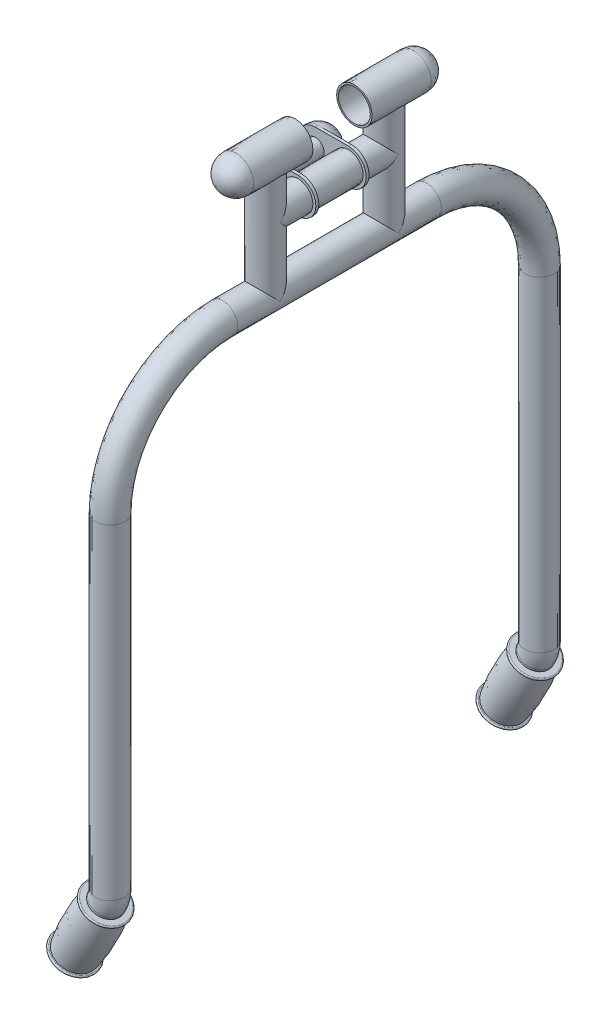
SolidWorks part; units mm, degrees
ref_plane "Plan de face" through (0, 0, 0) normal (0, 0, 1) x (1, 0, 0)
ref_plane "Plan de dessus" through (0, 0, 0) normal (0, 1, 0) x (1, 0, 0)
ref_plane "Plan de droite" through (0, 0, 0) normal (1, 0, 0) x (0, 0, -1)
sketch "Esquisse1" plane through (0, 0, 0) normal (1, 0, 0) x (0, 0, -1)
  line L0 (0, 0) -> (172.0867, 0)
  line L1 (362.6073, -190.5206) -> (362.6073, -734.2826)
  arc A0 (172.0867, 0) -> (362.6073, -190.5206) centre (172.0867, -190.5206) cw
sketch "Esquisse2" plane through (0, 0, 0) normal (0, 0, 1) x (1, 0, 0)
  circle A0 centre (0, 0) radius 22
  circle A1 centre (0, 0) radius 25
  dimension "D1" = 50
  dimension "D2" = 3
sweep "Balayage1" add profiles "Esquisse2" path "Esquisse1"
ref_plane "Plan1" through (0, 0, -362.6073) normal (0, 0, 1) x (1, 0, 0)
sketch "Esquisse3" plane through (0, 0, -362.6073) normal (0, 0, 1) x (1, 0, 0)
  line L0 (0, -734.2826) -> (0, -740)
  line L1 (-25, -734.2826) -> (25, -734.2826) construction
  line L2 (0, -190.5206) -> (0, -734.2826) construction
  line L3 (-4.7912, -759.331) -> (-57.8908, -859.8698)
  line L4 (0, -740) -> (-31.2746, -866.182) construction
  arc A0 (0, -740) -> (-4.7912, -759.331) centre (-41.3925, -740) cw
sketch "Esquisse4" plane through (0, -734.2826, 0) normal (0, -1, 0) x (1, 0, 0)
  circle A0 centre (0, -362.6073) radius 22 construction
  circle A1 centre (0, -362.6073) radius 25
  circle A2 centre (0, -362.6073) radius 25
  circle A3 centre (0, -362.6073) radius 22
  dimension "D1" = 0
sweep "Balayage2" add profiles "Esquisse4" path "Esquisse3"
ref_plane "Plan2" through (0, 200, 0) normal (0, 1, 0) x (-1, 0, 0)
sketch "Esquisse5" plane through (0, 200, 0) normal (0, 1, 0) x (-1, 0, 0)
  line L0 (0, -172.0867) -> (0, 0) construction
  circle A0 centre (0, -100) radius 25
  circle A1 centre (0, -100) radius 22
  dimension "D1" = 50
  dimension "D2" = 3
  dimension "D3" = 100
extrude "Boss.-Extru.1" add sketch "Esquisse5" against normal up to surface (225 mm away)
sketch "Esquisse6" plane through (0, 200, 0) normal (0, 1, 0) x (-1, 0, 0)
  line L0 (0, -172.0867) -> (0, 0) construction
  line L1 (0, -50) -> (-30, -50)
  line L2 (0, -50) -> (0, -150)
  line L3 (0, -150) -> (-30, -150)
  line L4 (-30, -50) -> (-30, -150)
  line L5 (0, -100) -> (-73.1334, -100) construction
  dimension "D1" = 100
  dimension "D2" = 30
revolve "Révolution1" add sketch "Esquisse6" angle 360 about L2
sketch "Esquisse7" plane through (0, 0, -150) normal (0, 0, -1) x (-1, 0, 0)
  circle A0 centre (0, 200) radius 27
  circle A1 centre (0, 200) radius 30 construction
  dimension "D1" = 3
extrude "Enlèv. mat.-Extru.1" cut sketch "Esquisse7" against normal through all
sketch "Esquisse8" plane through (-367.7167, -696.2352, 0) normal (-0.467, -0.8842, 0) x (0.8842, -0.467, 0)
  circle A0 centre (350.3832, -362.6073) radius 25 construction
  circle A1 centre (350.3832, -362.6073) radius 25
extrude "Boss.-Extru.2" add sketch "Esquisse8" along normal blind 3
sketch "Esquisse9" plane through (0, 0, 0) normal (0, 0, 1) x (1, 0, 0)
  line L0 (0, 0) -> (0, 170.0001) construction
  circle A0 centre (0, 115) radius 25
  circle A1 centre (0, 115) radius 22
  circle A2 centre (0, 200) radius 27 construction
  dimension "D1" = 50
  dimension "D2" = 3
  dimension "D3" = 85
extrude "Boss.-Extru.3" add sketch "Esquisse9" against normal up to surface (100 mm away)
sketch "Esquisse13" plane through (0, 0, -362.6073) normal (0, 0, 1) x (1, 0, 0)
  line L0 (-68.9651, -880.8378) -> (40.5546, -673.473) construction
  line L1 (-60.2259, -864.291) -> (-90.2904, -848.4125)
  line L2 (-88.4223, -844.8755) -> (-86.6538, -845.8095)
  line L3 (-86.6538, -845.8095) -> (-36.6831, -751.1949) construction
  line L4 (-36.6831, -751.1949) -> (-38.4516, -750.2608)
  line L5 (-36.5835, -746.7239) -> (-28.6253, -750.927)
  line L6 (-28.6253, -750.927) -> (-81.3981, -850.8471)
  line L7 (-81.3981, -850.8471) -> (-59.2919, -862.5225)
  line L9 (-59.2919, -862.5225) -> (-60.2259, -864.291)
  line L10 (-26.8975, -747.6556) -> (-81.3981, -850.8471) construction
  line L11 (-81.3981, -850.8471) -> (-37.1856, -874.1979) construction
  arc A0 (-90.2904, -848.4125) -> (-88.4223, -844.8755) centre (-89.3563, -846.644) cw
  arc A1 (-38.4516, -750.2608) -> (-36.5835, -746.7239) centre (-37.5175, -748.4923) cw
  arc A2 (-86.6538, -845.8095) -> (-36.6831, -751.1949) centre (285.6737, -981.951) cw
  dimension "D1" = 32
  dimension "D2" = 2
  dimension "D3" = 2
  dimension "D4" = 115
revolve "Révolution2" add sketch "Esquisse13" angle 360 about L0
ref_plane "Plan3" through (0, 0, -40) normal (0, 0, 1) x (1, 0, 0)
sketch "Esquisse10" plane through (0, 0, -40) normal (0, 0, 1) x (1, 0, 0)
  line L0 (0, 115) -> (-56, 115) construction
  line L1 (0, 85) -> (-56, 85)
  line L2 (0, 145) -> (-56, 145)
  arc A0 (0, 85) -> (0, 145) centre (0, 115) ccw
  arc A1 (-56, 145) -> (-56, 85) centre (-56, 115) ccw
  circle A2 centre (0, 115) radius 25 construction
  circle A3 centre (0, 115) radius 25 construction
  circle A4 centre (0, 115) radius 25
  circle A5 centre (-56, 115) radius 15
  point P3 (-28, 115)
  dimension "D1" = 5
  dimension "D2" = 30
  dimension "D3" = 56
extrude "Boss.-Extru.4" add sketch "Esquisse10" against normal blind 5
mirror "Symétrie1" about plane through (0, 0, 0) normal (0, 0, 1) of "Révolution2", "Boss.-Extru.2", "Enlèv. mat.-Extru.1", "Révolution1", "Boss.-Extru.1", "Balayage2", "Balayage1", "Boss.-Extru.3", "Boss.-Extru.4"
sketch "Esquisse11" plane through (0, 0, 0) normal (0, 0, 1) x (1, 0, 0)
  line L1 (-60.2259, -864.291) -> (-4.7912, -759.331) construction
  line L2 (17.315, -771.0064) -> (-26.8975, -747.6556) construction
  line L3 (-90.2904, -848.4125) -> (-30.1614, -880.1696) construction
  point P6 (-32.5086, -811.811)
ref_plane "Plan4" through (-56, 0, 0) normal (1, 0, 0) x (0, 0, -1)
sketch "Esquisse14" plane through (-56, 0, 0) normal (1, 0, 0) x (0, 0, -1)
  line L0 (82.0471, 115) -> (-75.392, 115) construction
  line L1 (75, 115) -> (-75, 115)
  line L2 (-45, 145) -> (-45, 85) construction
  line L3 (-45, 145) -> (-45, 130)
  line L4 (-45, 130) -> (45, 130)
  line L5 (45, 130) -> (45, 145)
  line L6 (45, 85) -> (45, 145) construction
  line L7 (0, 130) -> (0, 101.3478) construction
  line L8 (-40, 130) -> (-45, 130) construction
  line L9 (-45, 100) -> (-40, 100) construction
  line L10 (45, 90) -> (45, 140) construction
  arc A0 (-75, 115) -> (-45, 145) centre (-45, 115) cw
  arc A1 (45, 145) -> (75, 115) centre (45, 115) cw
revolve "Révolution3" add sketch "Esquisse14" angle 360 about L0
sketch "Esquisse15" plane through (0, 0, 0) normal (1, 0, 0) x (0, 0, -1)
  line L1 (-180, 200) -> (-150, 200)
  line L2 (-150, 200) -> (-150, 230)
  line L3 (150, 230) -> (150, 200)
  line L4 (150, 170) -> (150, 230) construction
  line L5 (150, 230) -> (50, 230) construction
  line L6 (150, 200) -> (180, 200)
  line L7 (-150, 230) -> (-150, 170) construction
  arc A0 (-150, 230) -> (-180, 200) centre (-150, 200) ccw
  arc A1 (180, 200) -> (150, 230) centre (150, 200) ccw
revolve "Révolution4" add sketch "Esquisse15" angle 360 about L6
